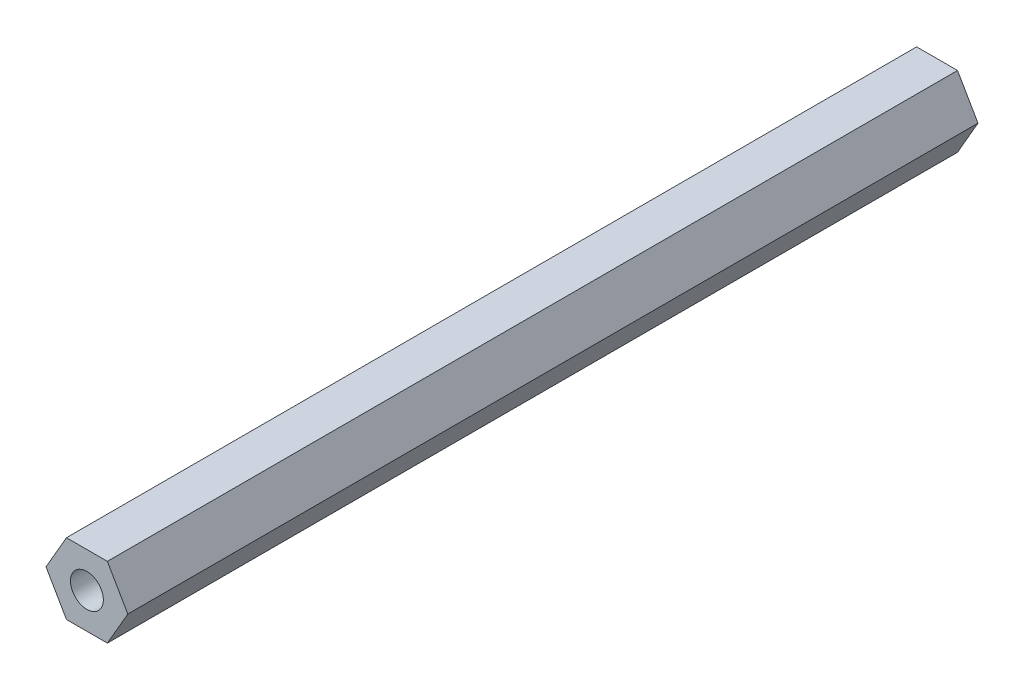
SolidWorks part; units mm, degrees
ref_plane "Front Plane" through (0, 0, 0) normal (0, 0, 1) x (1, 0, 0)
ref_plane "Top Plane" through (0, 0, 0) normal (0, 1, 0) x (1, 0, 0)
ref_plane "Right Plane" through (0, 0, 0) normal (1, 0, 0) x (0, 0, -1)
sketch "Sketch1" plane through (0, 0, 0) normal (0, 0, 1) x (1, 0, 0)
  line L1 (1.8331, -3.175) -> (3.6662, 0)
  line L2 (3.6662, 0) -> (1.8331, 3.175)
  line L3 (1.8331, 3.175) -> (-1.8331, 3.175)
  line L4 (-1.8331, 3.175) -> (-3.6662, 0)
  line L5 (-3.6662, 0) -> (-1.8331, -3.175)
  line L6 (-1.8331, -3.175) -> (1.8331, -3.175)
  circle A0 centre (0, 0) radius 3.175 construction
  dimension "D1" = 6.35
extrude "Extrude 3in" add sketch "Sketch1" along normal blind 76.2
sketch "Hex Sketch" [suppressed] plane through (0, 0, 0) normal (0, 0, 1) x (1, 0, 0)
  line L1 (1.8331, -3.175) -> (3.6662, 0)
  line L2 (3.6662, 0) -> (1.8331, 3.175)
  line L3 (1.8331, 3.175) -> (-1.8331, 3.175)
  line L4 (-1.8331, 3.175) -> (-3.6662, 0)
  line L5 (-3.6662, 0) -> (-1.8331, -3.175)
  line L6 (-1.8331, -3.175) -> (1.8331, -3.175)
  circle A0 centre (0, 0) radius 3.175 construction
  dimension "D1" = 6.35
sketch "Sketch7" [suppressed] plane through (0, 0, 0) normal (0, 0, 1) x (1, 0, 0)
  line L1 (1.8331, -3.175) -> (3.6662, 0)
  line L2 (3.6662, 0) -> (1.8331, 3.175)
  line L3 (1.8331, 3.175) -> (-1.8331, 3.175)
  line L4 (-1.8331, 3.175) -> (-3.6662, 0)
  line L5 (-3.6662, 0) -> (-1.8331, -3.175)
  line L6 (-1.8331, -3.175) -> (1.8331, -3.175)
  circle A0 centre (0, 0) radius 3.175 construction
extrude "Extrude 2in" [suppressed] add sketch "Sketch7" along normal blind 50.8
sketch "Sketch8" [suppressed] plane through (0, 0, 0) normal (0, 0, 1) x (1, 0, 0)
  line L1 (1.8331, -3.175) -> (3.6662, 0)
  line L2 (3.6662, 0) -> (1.8331, 3.175)
  line L3 (1.8331, 3.175) -> (-1.8331, 3.175)
  line L4 (-1.8331, 3.175) -> (-3.6662, 0)
  line L5 (-3.6662, 0) -> (-1.8331, -3.175)
  line L6 (-1.8331, -3.175) -> (1.8331, -3.175)
  circle A0 centre (0, 0) radius 3.175 construction
extrude "Boss-Extrude1" [suppressed] add sketch "Sketch8" along normal blind 101.6
hole_wizard "#4 Clearance Hole1" positions "Sketch10" profile "Sketch9" hole size "#4" standard "ANSI Inch"
sketch "Sketch10" plane through (0, 0, 101.6) normal (0, 0, 1) x (1, 0, 0)
  point P0 (0, 0)
sketch "Sketch9" plane through (0, 0, 101.6) normal (1, 0, 0) x (0, -1, 0)
  line L0 (0, 0) -> (0, 101.6)
  line L1 (0, 101.6) -> (1.6319, 101.6)
  line L2 (1.6319, 101.6) -> (1.6319, 0)
  line L5 (1.6319, 0) -> (0, 0)
  line L11 (0, -6.35) -> (0, 107.95) construction
  dimension "Thru Hole Dia." = 3.2639
  dimension "Thru Hole Depth" = 101.6
hole_wizard "#4 Clearance Hole2" positions "Sketch12" profile "Sketch11" hole size "#4" standard "ANSI Inch"
sketch "Sketch12" plane through (0, 0, 76.2) normal (0, 0, 1) x (1, 0, 0)
  point P0 (0, 0)
sketch "Sketch11" plane through (0, 0, 76.2) normal (1, 0, 0) x (0, -1, 0)
  line L0 (0, 0) -> (0, 76.2)
  line L1 (0, 76.2) -> (1.4732, 76.2)
  line L2 (1.4732, 76.2) -> (1.4732, 0)
  line L5 (1.4732, 0) -> (0, 0)
  line L11 (0, -6.35) -> (0, 107.95) construction
  dimension "Thru Hole Dia." = 2.9464
  dimension "Thru Hole Depth" = 76.2
